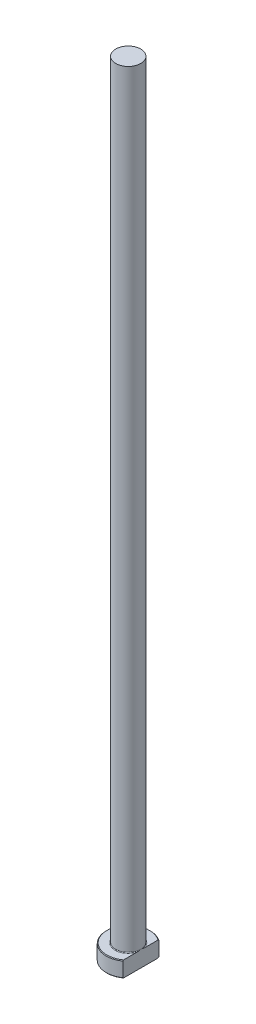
SolidWorks part; units mm, degrees
ref_plane "Front Plane" through (0, 0, 0) normal (0, 0, 1) x (1, 0, 0)
ref_plane "Top Plane" through (0, 0, 0) normal (0, 1, 0) x (1, 0, 0)
ref_plane "Right Plane" through (0, 0, 0) normal (1, 0, 0) x (0, 0, -1)
sketch "Sketch1" plane through (0, 0, 0) normal (0, 0, 1) x (1, 0, 0)
  line L0 (0, 259.9588) -> (0, -15.1925) construction
  line L1 (0, 0) -> (-7, 0)
  line L2 (-7, 0) -> (-7, 5)
  line L3 (-7, 5) -> (-4, 5)
  line L4 (-4, 5) -> (-4, 250)
  line L5 (-4, 250) -> (0, 250)
  line L6 (0, 250) -> (0, 0)
  dimension "L" = 250
  dimension "H" = 14
  dimension "T" = 5
  dimension "D" = 8
revolve "Revolve1" add sketch "Sketch1" angle 360 about L0
chamfer "Chamfer1" distance 0.2 angle 45 2 edges at (0, 5, 7) (0, 0, 7)
fillet "Fillet1" radius 0.2 1 edges at (0, 5, 4)
sketch "Sketch2" plane through (0, 0, 0) normal (0, 1, 0) x (1, 0, 0)
  line L0 (4, 5.7446) -> (4, -5.7446)
  circle A0 centre (0, 0) radius 7 construction
  arc A1 (4, -5.7446) -> (4, 5.7446) centre (0, 0) ccw
  circle A2 centre (0, 0) radius 4 construction
extrude "KEY" cut sketch "Sketch2" along normal through all
